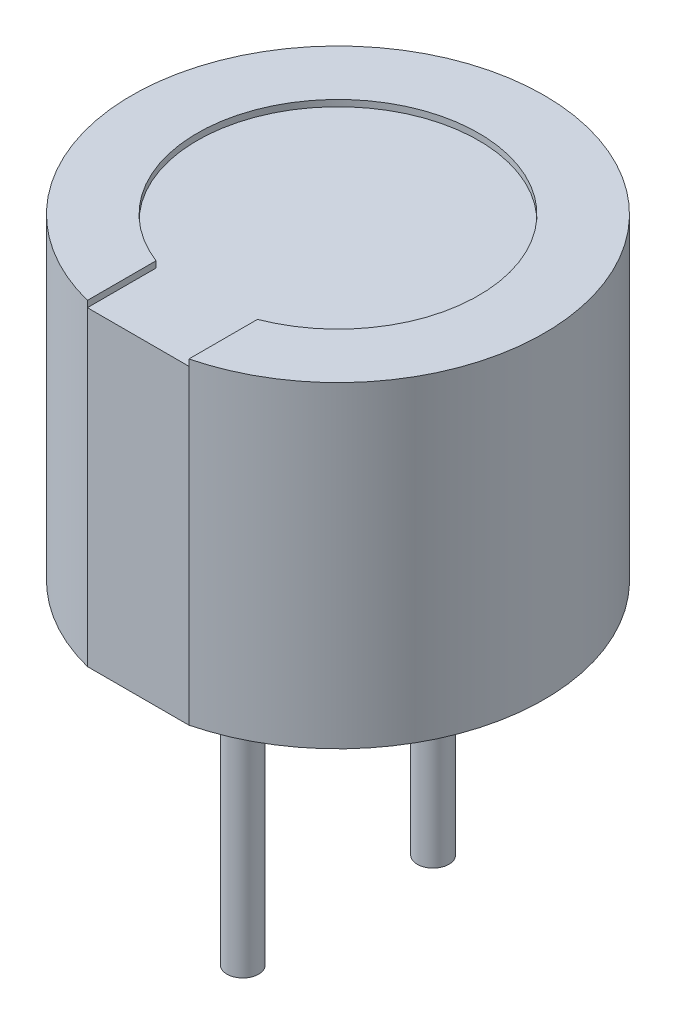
SolidWorks part; units mm, degrees
ref_plane "Plan de face" through (0, 0, 0) normal (0, 0, 1) x (1, 0, 0)
ref_plane "Plan de dessus" through (0, 0, 0) normal (0, 1, 0) x (1, 0, 0)
ref_plane "Plan de droite" through (0, 0, 0) normal (1, 0, 0) x (0, 0, -1)
sketch "Esquisse1" plane through (0, 0, 0) normal (0, 1, 0) x (1, 0, 0)
  circle A0 centre (0, 0) radius 3.25
  dimension "D1" = 6.5
extrude "Extrusion1" add sketch "Esquisse1" along normal blind 5
ref_plane "Plan1" through (0, 0, 3.25) normal (0, 0, 1) x (1, 0, 0)
sketch "Esquisse2" plane through (0, 0, 3.25) normal (0, 0, 1) x (1, 0, 0)
  line L0 (-3.25, 0) -> (3.25, 0) construction
  line L1 (-1, 0) -> (1, 0)
  line L2 (-1, 0) -> (-1, 5)
  line L3 (-1, 5) -> (1, 5)
  line L4 (1, 0) -> (1, 5)
  line L5 (3.25, 5) -> (-3.25, 5) construction
  dimension "D1" = 2
extrude "Enlèv. mat.-Extru.1" cut sketch "Esquisse2" against normal blind 0.1
sketch "Esquisse3" plane through (0, 0, 0) normal (0, -1, 0) x (1, 0, 0)
  circle A0 centre (0, 1.5) radius 0.25
  circle A1 centre (0, -1.5) radius 0.25
  dimension "D3" = 0.5
  dimension "D1" = 3
  dimension "D2" = 1.5
extrude "Extrusion2" add sketch "Esquisse3" along normal blind 4.5
sketch "Esquisse4" plane through (0, 5, 0) normal (0, 1, 0) x (-1, 0, 0)
  line L0 (-0.8, 2.0688) -> (-0.8, 3.15)
  line L1 (0.8, 2.0688) -> (0.8, 3.15)
  line L2 (0.8, 3.15) -> (-0.8, 3.15)
  arc A0 (-0.8, 2.0688) -> (0.8, 2.0688) centre (0, 0) ccw
extrude "Enlèv. mat.-Extru.2" cut sketch "Esquisse4" against normal blind 0.1
